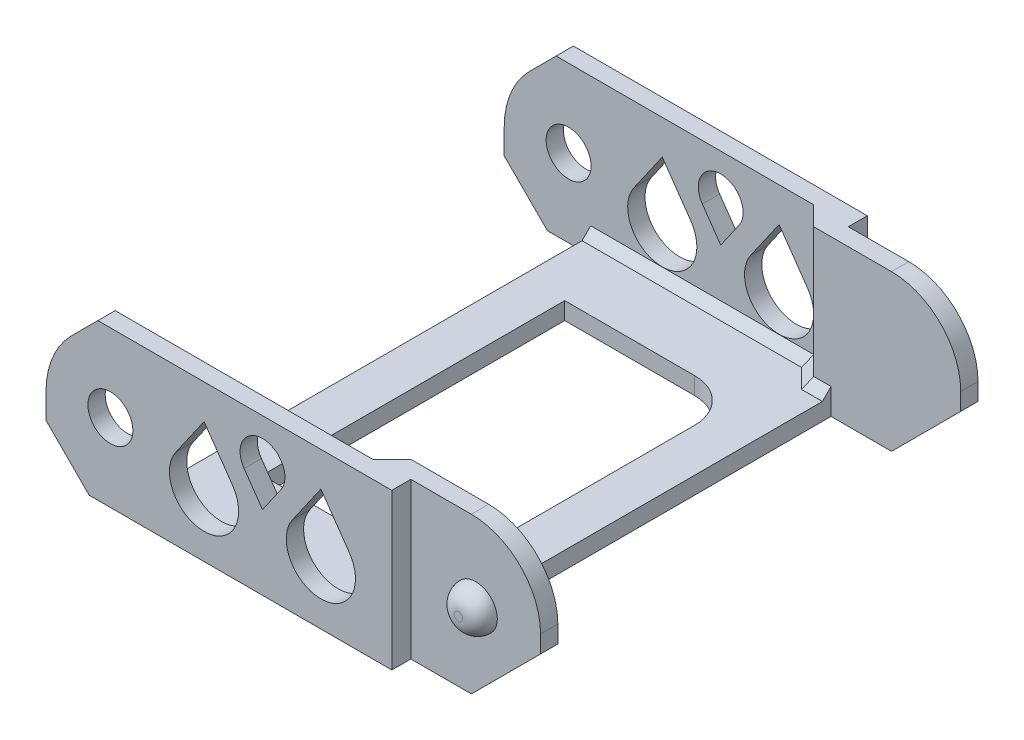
SolidWorks part; units mm, degrees
ref_plane "Plan de face" through (0, 0, 0) normal (0, 0, 1) x (1, 0, 0)
ref_plane "Plan de dessus" through (0, 0, 0) normal (0, 1, 0) x (1, 0, 0)
ref_plane "Plan de droite" through (0, 0, 0) normal (1, 0, 0) x (0, 0, -1)
sketch "Esquisse1" plane through (0, 0, 0) normal (0, 1, 0) x (1, 0, 0)
  line L0 (0, -46.5592) -> (0, 8.4408)
  line L1 (0, -46.5592) -> (-30, -46.5592)
  line L2 (-25, -1.5592) -> (-25, -36.5592)
  line L3 (-30, 8.4408) -> (0, 8.4408)
  line L4 (-25, -1.5592) -> (-10, -1.5592)
  line L5 (-25, -36.5592) -> (-10, -36.5592)
  line L7 (-5, -6.5592) -> (-5, -31.5592)
  line L9 (-30, 8.4408) -> (-30, -46.5592)
  arc A1 (-10, -36.5592) -> (-5, -31.5592) centre (-10, -31.5592) ccw
  arc A2 (-10, -1.5592) -> (-5, -6.5592) centre (-10, -6.5592) cw
  dimension "D1" = 10
  dimension "D2" = 10
  dimension "D3" = 30
  dimension "D4" = 5
  dimension "D5" = 5
extrude "Boss.-Extru.1" add sketch "Esquisse1" along normal blind 2
sketch "Esquisse2" plane through (0, 0, 0) normal (0, -1, 0) x (1, 0, 0)
  line L0 (-40, 46.5592) -> (0, 46.5592)
  line L1 (0, 46.5592) -> (0, 44.3592)
  line L2 (0, 46.5592) -> (0, -8.4408) construction
  line L3 (0, 44.3592) -> (15, 44.3592)
  line L4 (-40, 44.5592) -> (-2, 44.5592)
  line L5 (-2, 44.5592) -> (-2, 42.3592)
  line L6 (-2, 42.3592) -> (15, 42.3592)
  line L7 (15, 42.3592) -> (15, 44.3592)
  line L8 (-40, 44.5592) -> (-40, 46.5592)
  line L11 (-40, -6.4408) -> (-40, -8.4408)
  line L12 (15, -4.2408) -> (15, -6.2408)
  line L13 (-2, -4.2408) -> (15, -4.2408)
  line L14 (-2, -6.4408) -> (-2, -4.2408)
  line L15 (-40, -6.4408) -> (-2, -6.4408)
  line L16 (0, -6.2408) -> (15, -6.2408)
  line L17 (0, -8.4408) -> (0, -6.2408)
  line L18 (-40, -8.4408) -> (0, -8.4408)
  dimension "D1" = 2
extrude "Boss.-Extru.2" add sketch "Esquisse2" against normal blind 18
chamfer "Chanfrein1" distance 2.2 angle 45 2 edges at (-2, 10, 44.5592) (-2, 10, -6.4408)
sketch "Esquisse4" plane through (0, 0, -6.2408) normal (0, 0, -1) x (-1, 0, 0)
  circle A0 centre (-7.5, 9) radius 2.5
extrude "Boss.-Extru.3" add sketch "Esquisse4" along normal blind 2
chamfer "Chanfrein2" distance 8 angle 45 1 edges at (15, 0, -5.2408)
fillet "Congé1" radius 8 1 edges at (15, 18, -5.2408)
fillet "Congé2" radius 2 1 edges at (5, 9, -8.2408)
sketch "Esquisse5" plane through (0, 0, 44.3592) normal (0, 0, 1) x (1, 0, 0)
  circle A0 centre (7.5, 9) radius 2.5
extrude "Boss.-Extru.4" add sketch "Esquisse5" along normal blind 2
fillet "Congé3" radius 2 1 edges at (10, 9, 46.3592)
fillet "Congé4" radius 8 1 edges at (15, 18, 43.3592)
chamfer "Chanfrein3" distance 8 angle 45 1 edges at (15, 0, 43.3592)
sketch "Esquisse7" plane through (0, 0, 46.5592) normal (0, 0, 1) x (1, 0, 0)
  circle A0 centre (-32.553, 9.0004) radius 2.6
extrude "Enlèv. mat.-Extru.2" cut sketch "Esquisse7" against normal blind 85
chamfer "Chanfrein5" distance 6 angle 45 2 edges at (-40, 18, -7.4408) (-40, 18, 45.5592)
fillet "Congé5" radius 10 2 edges at (-40, 12, 45.5592) (-40, 12, -7.4408)
chamfer "Chanfrein6" distance 5 angle 45 2 edges at (-40, 0, 45.5592) (-40, 0, -7.4408)
sketch "Esquisse8" plane through (0, 0, 46.5592) normal (0, 0, 1) x (1, 0, 0)
  line L0 (-21.7178, 14.0243) -> (-24.9447, 9.3877)
  line L1 (-21.7178, 14.0243) -> (-18.4353, 9.3098)
  line L2 (-8.2053, 14.0243) -> (-11.4879, 9.3096)
  line L3 (-8.2053, 14.0243) -> (-4.9228, 9.3097)
  arc A0 (-24.9447, 9.3877) -> (-18.4353, 9.3098) centre (-21.7178, 7.0243) ccw
  arc A1 (-11.4878, 9.3098) -> (-4.9228, 9.3097) centre (-8.2053, 7.0243) ccw
extrude "Enlèv. mat.-Extru.3" cut sketch "Esquisse8" against normal blind 68 contours L0 A0 L1 | L2 A1 L3
chamfer "Chanfrein7" distance 1 angle 45 6 edges at (-1, 2, -4.2408) (-3.1, 2, -5.3408) (-17.1, 2, -6.4408) (-1, 2, 42.3592) (-3.1, 2, 43.4592) (-17.1, 2, 44.5592)
sketch "Esquisse9" plane through (0, 0, 46.5592) normal (0, 0, 1) x (1, 0, 0)
  line L0 (-14.9582, 8.5873) -> (-12.8672, 11.5918)
  line L1 (-14.9582, 8.5873) -> (-17.0853, 11.6423)
  arc A0 (-12.8672, 11.5918) -> (-17.0853, 11.6423) centre (-14.9582, 13.1233) ccw
extrude "Enlèv. mat.-Extru.4" cut sketch "Esquisse9" against normal blind 68
